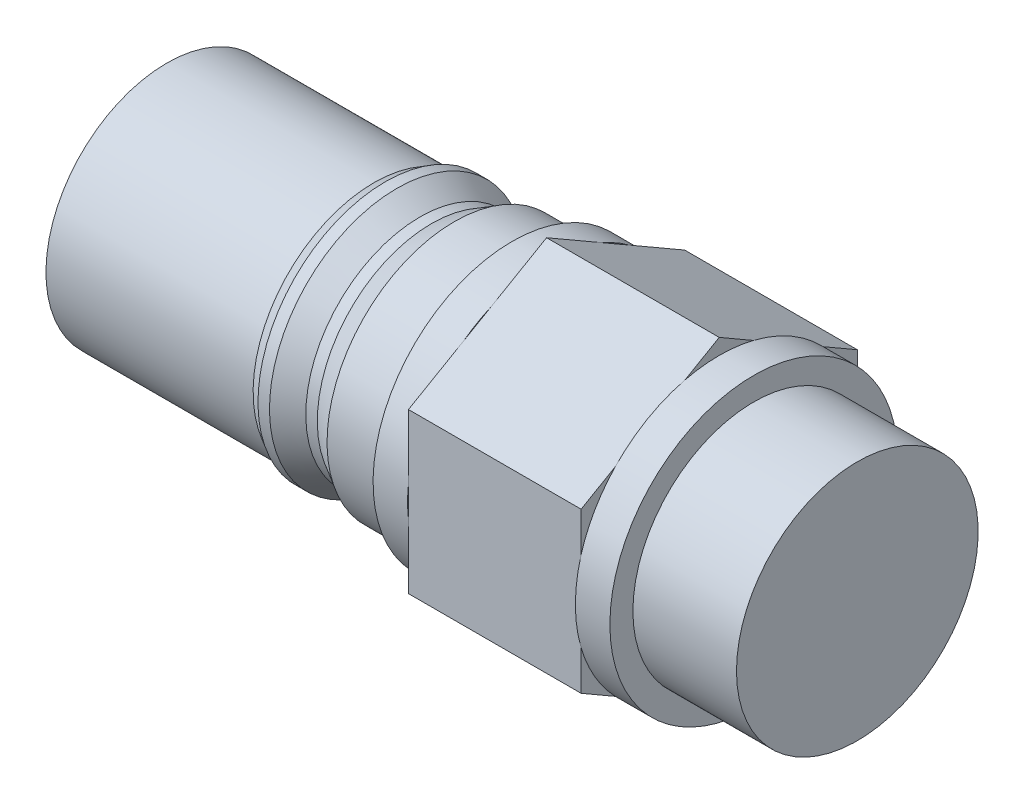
SolidWorks part; units mm, degrees
ref_plane "Alzado" through (0, 0, 0) normal (0, 0, 1) x (1, 0, 0)
ref_plane "Planta" through (0, 0, 0) normal (0, 1, 0) x (1, 0, 0)
ref_plane "Vista lateral" through (0, 0, 0) normal (1, 0, 0) x (0, 0, -1)
sketch "Croquis1" plane through (0, 0, 0) normal (0, 0, 1) x (1, 0, 0)
  line L0 (0, 0) -> (33, 0) construction
  line L1 (0, 0) -> (0, 10.5)
  line L2 (0, 10.5) -> (18, 10.5)
  line L3 (18, 10.5) -> (19, 11.0774)
  line L4 (19, 11.0774) -> (20, 11.0774)
  line L5 (19.5, 11.0774) -> (19.5, 0) construction
  line L6 (21, 10.5) -> (20, 11.0774)
  line L7 (21, 10.5) -> (22, 9.9226)
  line L8 (22, 9.9226) -> (23, 9.9226)
  line L9 (22.5, 9.9226) -> (22.5, 0) construction
  line L10 (24, 10.5) -> (23, 9.9226)
  line L11 (24, 10.5) -> (25, 11.0774)
  line L12 (25, 11.0774) -> (30, 11.0774)
  line L14 (33, 0) -> (0, 0)
  line L15 (30, 11.0774) -> (30, 12.0774)
  line L16 (30, 12.0774) -> (33, 12.0774)
  line L17 (33, 12.0774) -> (33, 0)
  point P18 (27.5743, 0)
  dimension "D1" = 21
  dimension "D2" = 18
  dimension "D3" = 1
  dimension "D4" = 1
  dimension "D5" = 150
  dimension "D6" = 1
  dimension "D7" = 1
  dimension "D8" = 5
  dimension "D9" = 1
  dimension "D10" = 3
revolve "Revolución1" add sketch "Croquis1" angle 360 about L14
sketch "Croquis8" plane through (33, 0, 0) normal (1, 0, 0) x (0, 0, -1)
  line L1 (0, 13.8564) -> (-12, 6.9282)
  line L2 (-12, 6.9282) -> (-12, -6.9282)
  line L3 (-12, -6.9282) -> (0, -13.8564)
  line L4 (0, -13.8564) -> (12, -6.9282)
  line L5 (12, -6.9282) -> (12, 6.9282)
  line L6 (12, 6.9282) -> (0, 13.8564)
  circle A0 centre (0, 0) radius 12 construction
  dimension "D1" = 24
extrude "Saliente-Extruir6" add sketch "Croquis8" along normal blind 15
sketch "Croquis10" plane through (0, 0, 0) normal (0, 0, 1) x (1, 0, 0)
  line L0 (48, 0) -> (60, 0) construction
  line L1 (48, 6.9282) -> (48, -6.9282) construction
  line L2 (60, 0) -> (60, 10.5)
  line L3 (60, 10.5) -> (51, 10.5)
  line L4 (51, 10.5) -> (51, 12.5)
  line L5 (51, 12.5) -> (48, 12.5)
  line L6 (48, 12.5) -> (48, 0)
  line L7 (48, 0) -> (60, 0)
  line L8 (48, 0) -> (108.8542, 0) construction
  dimension "D1" = 12
  dimension "D2" = 3
  dimension "D3" = 21
  dimension "D4" = 2
revolve "Revolución3" add sketch "Croquis10" angle 360 about L8
